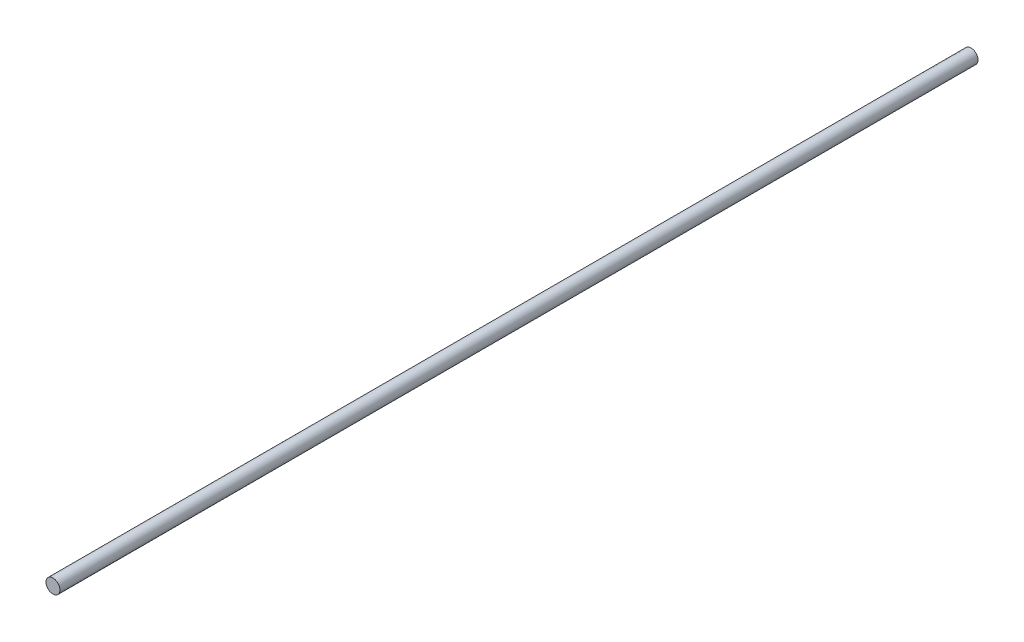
SolidWorks part; units mm, degrees
ref_plane "Front Plane" through (0, 0, 0) normal (0, 0, 1) x (1, 0, 0)
ref_plane "Top Plane" through (0, 0, 0) normal (0, 1, 0) x (1, 0, 0)
ref_plane "Right Plane" through (0, 0, 0) normal (1, 0, 0) x (0, 0, -1)
sketch "Sketch1" plane through (0, 0, 0) normal (0, 0, 1) x (1, 0, 0)
  circle A0 centre (0, 0) radius 30
  dimension "D1" = 60
extrude "Boss-Extrude1" add sketch "Sketch1" against normal blind 3950
